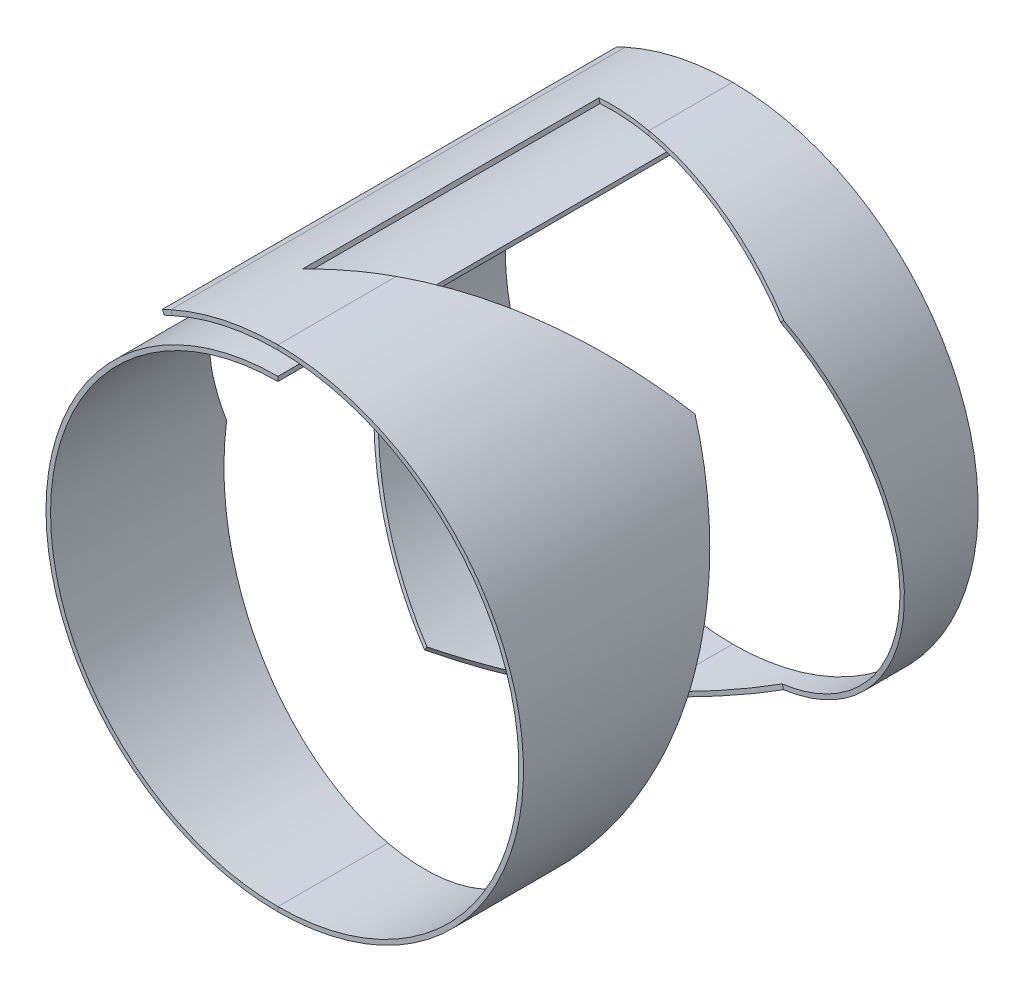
SolidWorks part; units mm, degrees
ref_plane "Vorne" through (0, 0, 0) normal (0, 0, 1) x (1, 0, 0)
ref_plane "Oben" through (0, 0, 0) normal (0, 1, 0) x (1, 0, 0)
ref_plane "Rechts" through (0, 0, 0) normal (1, 0, 0) x (0, 0, -1)
sketch "Skizze1" plane through (0, 0, 0) normal (0, 0, 1) x (1, 0, 0)
  line L0 (-23.1794, 50.9776) -> (-25, 50.1498)
  line L1 (0, 51) -> (0, 50)
  line L2 (-25, 50.1498) -> (-25.4139, 51.0601)
  line L3 (-25.4139, 51.0601) -> (-23.5933, 51.8879)
  arc A0 (0, 50) -> (0, -50) centre (0, 0) ccw
  arc A1 (0, -50) -> (0, 56) centre (0, 3) ccw
  arc A2 (0, 56) -> (-23.1794, 50.9776) centre (0, 0) ccw
  arc A3 (0, 51) -> (0, -51) centre (0, 0) ccw
  arc A4 (0, -51) -> (0, 57) centre (0, 3) ccw
  arc A5 (0, 57) -> (-23.5933, 51.8879) centre (0, 0) ccw
  dimension "D2" = 53
  dimension "D3" = 1
  dimension "D1" = 50
  dimension "D4" = 2
  dimension "D5" = 25
extrude "Linear austragen1" add sketch "Skizze1" along normal blind 100
sheet metal parameters "Blech1" parameters "D1"=30, "Dicke"=1
bend "Biegung-Rundung2" bend radius 56 bend angle 24.451 parameters "D5"=1
flatten bends "Abwickeln1" parameters "D1"=0
sketch "Skizze-Winkel1" plane through (-23.5933, 51.8879, 0) normal (-0.4139, 0.9103, 0) x (-0.9103, -0.4139, 0)
  line L0 (-12.0558, 0) -> (-12.0558, 100) construction
  line L1 (-108.1492, 0) -> (-108.1492, 100) construction
  line L2 (-271.512, 0) -> (-271.512, 100) construction
bend "Biegung-Rundung1" bend radius 53 bend angle 180 parameters "D5"=2
bend "Biegung-Rundung3" bend radius 50 bend angle 180 parameters "D5"=3
sketch "Skizze6" plane through (-23.5933, 51.8879, 0) normal (-0.4139, 0.9103, 0) x (-0.9103, -0.4139, 0)
  line L0 (-326.515, 25.3897) -> (-301.6829, 72.3932)
  line L1 (-301.6829, 72.3932) -> (-269.756, 61.3075)
  line L2 (-269.756, 61.3075) -> (-162.8894, 81.2618)
  line L3 (-162.8894, 81.2618) -> (-69.6628, 48.8914)
  line L4 (-69.6628, 48.8914) -> (-10.7931, 81.2618)
  line L5 (-10.7931, 81.2618) -> (-10.7931, 16.0776)
  line L6 (-10.7931, 16.0776) -> (-64.0046, 25.3897)
  line L7 (-64.0046, 25.3897) -> (-176.5215, 4.3803)
  line L8 (-176.5215, 4.3803) -> (-219.6484, 41.3531)
  line L9 (-219.6484, 41.3531) -> (-306.6311, 14.885)
  line L10 (-306.6311, 14.885) -> (-326.515, 25.3897)
extrude "Schnitt-Linear austragen2" cut sketch "Skizze6" against normal through all
process bends "Abbiegen1" parameters "D1"=0
sketch "Abwicklung-Skizze1" plane through (-23.5933, 51.8879, 0) normal (-0.4139, 0.9103, 0) x (-0.9103, -0.4139, 0)
flat pattern "Abwicklung1"
sketch "Biegung-Linien1" plane through (-23.5933, 51.8879, 0) normal (-0.4139, 0.9103, 0) x (-0.9103, -0.4139, 0)
  line L0 (-271.512, 100) -> (-271.512, 0) construction
  line L1 (-108.1492, 100) -> (-108.1492, 0) construction
  line L2 (-12.0558, 100) -> (-12.0558, 0) construction
bend of the flat pattern "Abwickeln-<Biegung-Rundung1>1"
bend of the flat pattern "Abwickeln-<Biegung-Rundung2>1"
bend of the flat pattern "Abwickeln-<Biegung-Rundung3>1"
